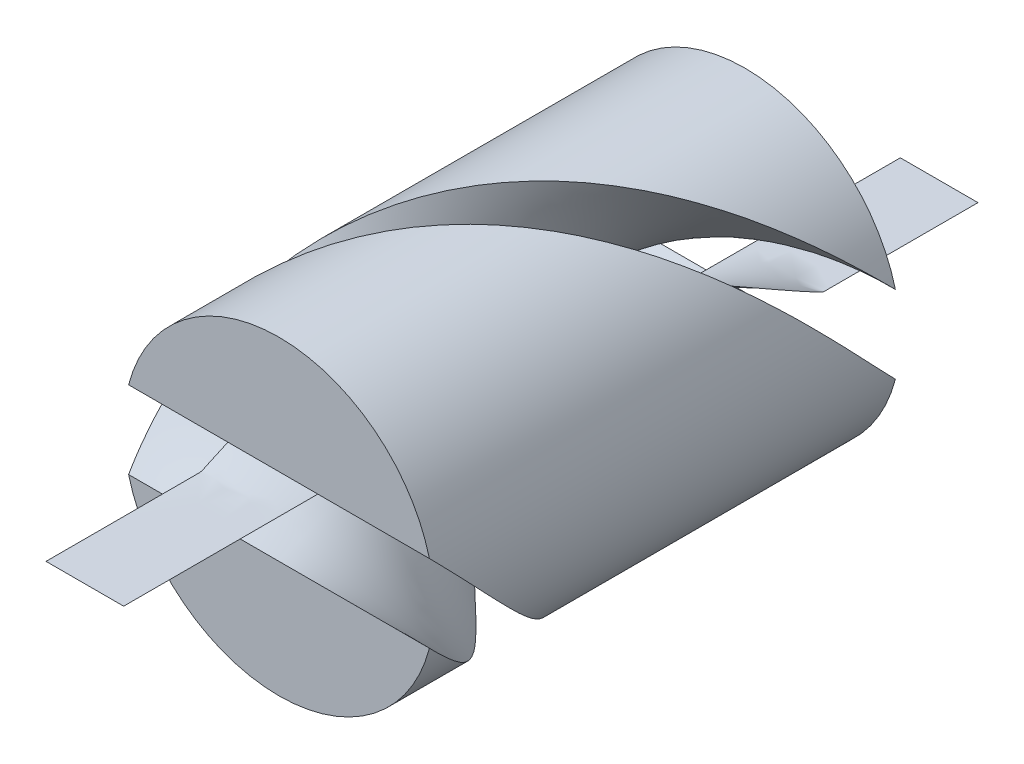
SolidWorks part; units mm, degrees
ref_plane "Ebene vorne" through (0, 0, 0) normal (0, 0, 1) x (1, 0, 0)
ref_plane "Ebene oben" through (0, 0, 0) normal (0, 1, 0) x (1, 0, 0)
ref_plane "Ebene rechts" through (0, 0, 0) normal (1, 0, 0) x (0, 0, -1)
sketch "Skizze1" plane through (0, 0, 0) normal (0, 0, 1) x (1, 0, 0)
  circle A0 centre (0, 0) radius 50
  dimension "D1" = 100
extrude "Linear austragen1" add sketch "Skizze1" along normal blind 150
sketch "Skizze2" plane through (0, 0, 0) normal (0, 0, -1) x (-1, 0, 0)
  line L0 (0, 0) -> (25.4004, 0) construction
  line L3 (-48.4123, 12.5) -> (48.4123, 12.5)
  line L5 (-48.4123, -12.5) -> (48.4123, -12.5)
  circle A1 centre (0, 0) radius 50 construction
  arc A2 (-48.4123, 12.5) -> (-48.4123, -12.5) centre (0, 0) ccw
  arc A3 (48.4123, -12.5) -> (48.4123, 12.5) centre (0, 0) ccw
  dimension "D2" = 25
sketch "Skizze3" plane through (0, 0, 0) normal (1, 0, 0) x (0, 0, -1)
  line L0 (0, 0) -> (-150, 0)
  line L1 (-150, 50) -> (-150, -50) construction
sweep "Schnitt-Austragung1" cut profiles "Skizze2" path "Skizze3" parameters "D1"=180
sketch "Skizze4" plane through (0, 0, 0) normal (0, 0, 1) x (1, 0, 0)
  circle A0 centre (0, 0) radius 25
  dimension "D1" = 50
curve "Spirale/Helix1"
sketch "Skizze5" plane through (0, 0, 0) normal (0, 1, 0) x (1, 0, 0)
  line L0 (25, 0) -> (25, 50)
  line L1 (-25, -150) -> (-25, -200)
  dimension "D1" = 50
sketch3d "3D-Skizze1"
  line L0 (25, 0, 0) -> (25, 0, -50) construction
  line L1 (25, 0, 0) -> (25, 0, -50) construction
  line L2 (-25, 0, 150) -> (-25, 0, 200) construction
  line L3 (-25, 0, 150) -> (-25, 0, 200) construction
  spline S0 degree 3 poles (25, 0, -50) (25, 0, -33.681) (25, 0, -17.362) (25, 0, -1.0429) (25, 0, -0.8173) (25, 0, -0.366) (25.0001, 0.1723, 0.329) (24.9973, 0.3816, 0.7288) (24.9953, 0.4862, 0.9287) (24.9665, 1.9597, 3.7434) (24.6304, 5.0648, 9.6851) (23.2459, 9.6287, 18.7499) (20.9207, 13.9788, 28.125) (17.7916, 17.7916, 37.5) (13.9788, 20.9207, 46.875) (9.6288, 23.2459, 56.25) (4.9087, 24.6777, 65.625) (0, 25.1612, 75) (-4.9087, 24.6777, 84.375) (-9.6288, 23.2459, 93.75) (-13.9788, 20.9207, 103.125) (-17.7916, 17.7916, 112.5) (-20.9207, 13.9788, 121.875) (-23.2459, 9.6287, 131.2501) (-24.6304, 5.0648, 140.3149) (-24.9665, 1.9597, 146.2566) (-24.9953, 0.4862, 149.0713) (-24.9973, 0.3816, 149.2712) (-25.0001, 0.1723, 149.671) (-25, 0, 150.366) (-25, 0, 150.8173) (-25, 0, 151.0429) (-25, 0, 167.362) (-25, 0, 183.681) (-25, 0, 200) knots 0 0 0 0 0.18189 0.18189 0.18189 0.184405 0.18692 0.189435 0.189435 0.189435 0.224848 0.264155 0.303463 0.34277 0.382078 0.421385 0.460693 0.5 0.539307 0.578615 0.617922 0.65723 0.696537 0.735845 0.775152 0.810565 0.810565 0.810565 0.81308 0.815595 0.81811 0.81811 0.81811 1 1 1 1
  spline S1 degree 3 poles (25, 0, 0) (25, 1.6357, 3.1239) (24.6777, 4.909, 9.3755) (23.2459, 9.6287, 18.7499) (20.9207, 13.9788, 28.125) (17.7916, 17.7916, 37.5) (13.9788, 20.9207, 46.875) (9.6288, 23.2459, 56.25) (4.9087, 24.6777, 65.625) (0, 25.1612, 75) (-4.9087, 24.6777, 84.375) (-9.6288, 23.2459, 93.75) (-13.9788, 20.9207, 103.125) (-17.7916, 17.7916, 112.5) (-20.9207, 13.9788, 121.875) (-23.2459, 9.6287, 131.2501) (-24.6777, 4.909, 140.6245) (-25, 1.6357, 146.8761) (-25, 0, 150) knots 0 0 0 0 0.0625 0.125 0.1875 0.25 0.3125 0.375 0.4375 0.5 0.5625 0.625 0.6875 0.75 0.8125 0.875 0.9375 1 1 1 1
  spline S2 degree 3 poles (25, 0, 0) (25, 1.6357, 3.1239) (24.6777, 4.909, 9.3755) (23.2459, 9.6287, 18.7499) (20.9207, 13.9788, 28.125) (17.7916, 17.7916, 37.5) (13.9788, 20.9207, 46.875) (9.6288, 23.2459, 56.25) (4.9087, 24.6777, 65.625) (0, 25.1612, 75) (-4.9087, 24.6777, 84.375) (-9.6288, 23.2459, 93.75) (-13.9788, 20.9207, 103.125) (-17.7916, 17.7916, 112.5) (-20.9207, 13.9788, 121.875) (-23.2459, 9.6287, 131.2501) (-24.6777, 4.909, 140.6245) (-25, 1.6357, 146.8761) (-25, 0, 150) knots 0 0 0 0 0.0625 0.125 0.1875 0.25 0.3125 0.375 0.4375 0.5 0.5625 0.625 0.6875 0.75 0.8125 0.875 0.9375 1 1 1 1 construction
  dimension "D1" = 0
ref_plane "Ebene1" through (0, 0, -50) normal (0, 0, 1) x (1, 0, 0)
sketch "Skizze6" plane through (0, 0, -50) normal (0, 0, 1) x (1, 0, 0)
  line L0 (25, 0) -> (0, 0)
sketch "Skizze7" plane through (0, 0, 0) normal (0, 1, 0) x (1, 0, 0)
  line L0 (0, 50) -> (0, -200)
surface "Oberfläche-Austragung1"
